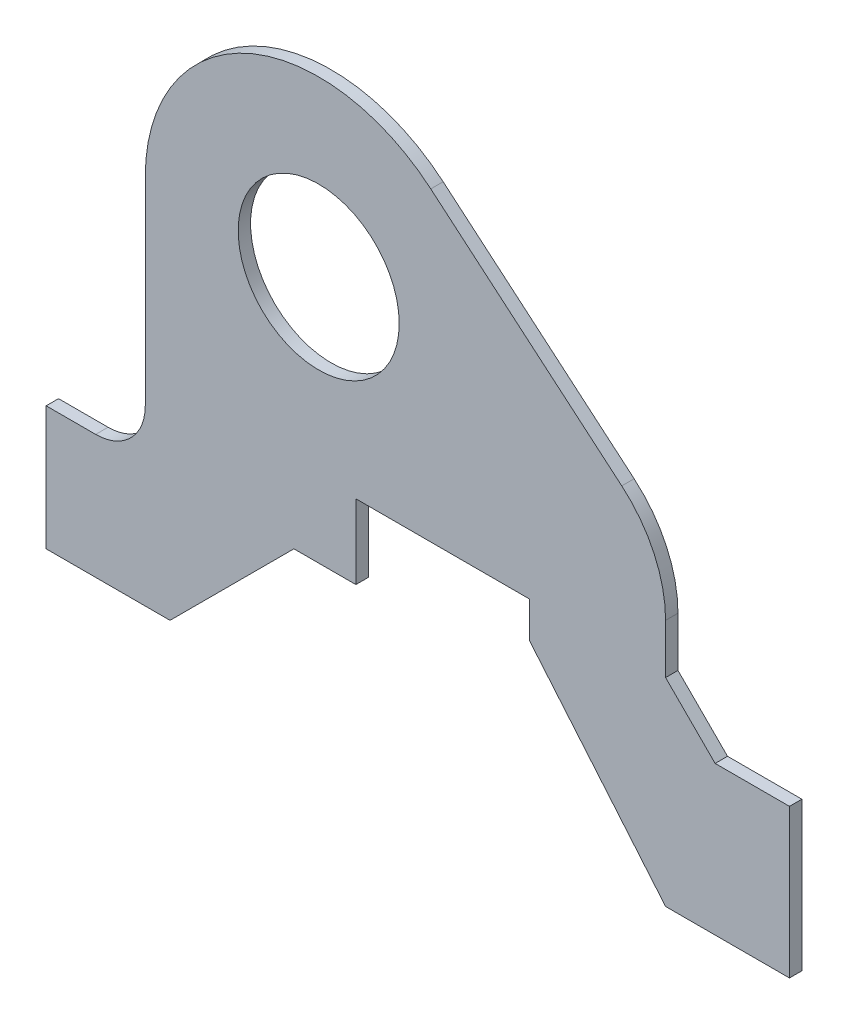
SolidWorks part; units mm, degrees
ref_plane "Alzado" through (0, 0, 0) normal (0, 0, 1) x (1, 0, 0)
ref_plane "Planta" through (0, 0, 0) normal (0, 1, 0) x (1, 0, 0)
ref_plane "Vista lateral" through (0, 0, 0) normal (1, 0, 0) x (0, 0, -1)
sketch "Croquis1" plane through (0, 0, 0) normal (0, 0, 1) x (1, 0, 0)
  line L0 (0, 0) -> (0, 10)
  line L1 (0, 10) -> (4, 10)
  line L2 (8, 14) -> (8, 30)
  line L3 (54, 12) -> (60, 12)
  line L4 (60, 12) -> (60, 0)
  line L5 (60, 0) -> (50, 0)
  line L7 (20, 10) -> (10, 0)
  line L8 (10, 0) -> (0, 0)
  line L9 (20, 10) -> (25, 10)
  line L11 (25, 10) -> (25, 16)
  line L12 (25, 16) -> (39, 16)
  line L14 (39, 16) -> (39, 13.1093)
  line L15 (39, 13.1093) -> (50, 0)
  line L16 (31.0468, 40.6843) -> (46.462, 27.6317)
  line L17 (54, 12) -> (50, 16)
  line L18 (50, 16) -> (50, 20)
  arc A0 (8, 30) -> (31.0468, 40.6843) centre (22, 30) cw
  circle A5 centre (22, 30) radius 6.5
  arc A7 (4, 10) -> (8, 14) centre (4, 14) ccw
  arc A8 (50, 20) -> (46.462, 27.6317) centre (40, 20) ccw
  point P8 (57.4033, 0)
  point P21 (50.2199, 27.6701)
  dimension "D3" = 14
  dimension "D4" = 22
  dimension "D7" = 45
  dimension "D10" = 10
  dimension "D11" = 20
  dimension "D12" = 14
  dimension "D13" = 10
  dimension "D14" = 13
  dimension "D15" = 10
  dimension "D16" = 4
  dimension "D1" = 60
  dimension "D2" = 30
  dimension "D5" = 10
  dimension "D6" = 12
  dimension "D8" = 25
  dimension "D9" = 16
  dimension "D17" = 45
  dimension "D18" = 50
  dimension "D19" = 20
  dimension "D20" = 4
  dimension "D21" = 10
extrude "Saliente-Extruir1" add sketch "Croquis1" along normal blind 1
